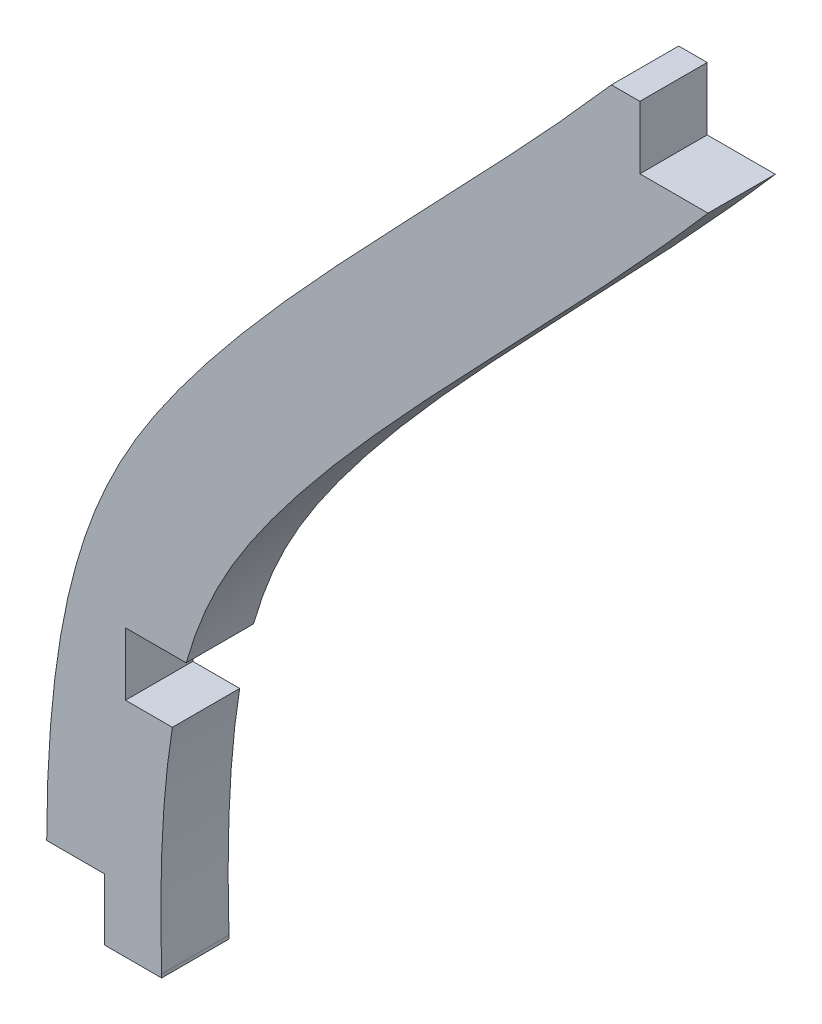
SolidWorks part; units mm, degrees
ref_plane "Front Plane" through (0, 0, 0) normal (0, 0, 1) x (1, 0, 0)
ref_plane "Top Plane" through (0, 0, 0) normal (0, 1, 0) x (1, 0, 0)
ref_plane "Right Plane" through (0, 0, 0) normal (1, 0, 0) x (0, 0, -1)
sketch "Sketch2" plane through (0, 0, 0) normal (0, 0, 1) x (1, 0, 0)
  line L0 (0, 0) -> (0, 106.68) construction
  line L1 (0, 0) -> (-76.2, 0) construction
  line L2 (0, 106.68) -> (-28.575, 106.68) construction
  line L3 (0, 0) -> (0, 106.68) construction
  line L4 (-75.27, 12.7) -> (0, 12.7) construction
  line L5 (-51.0976, 44.45) -> (0, 44.45) construction
  line L6 (-71.1223, 0.1523) -> (-71.1223, 0)
  line L7 (-71.1223, 0) -> (-76.2, 0)
  line L8 (-28.575, 106.68) -> (-23.5432, 106.68)
  line L10 (-23.5432, 105.9822) -> (-23.5432, 106.68)
  spline S0 degree 3 poles (-76.2, 0) (-76.5697, 12.3264) (-70.4254, 26.7635) (-35.695, 54.9593) (-31.1223, 88.3123) (-28.575, 106.68) knots 0 0 0 0 0.192928 0.526147 1 1 1 1
  spline S1 degree 1 poles (-71.1223, 0.1523) (-23.5432, 105.9822) knots 0 0 1 1 construction
  spline S2 degree 3 poles (-71.1223, 0.1523) (-71.1361, 0.6121) (-71.1567, 1.5498) (-71.1646, 3.2821) (-71.1168, 5.2862) (-70.9731, 7.4216) (-70.6767, 9.951) (-70.1306, 12.5718) (-69.2454, 15.1046) (-68.1202, 17.3344) (-66.6722, 19.5511) (-64.8631, 21.9349) (-62.1184, 25.2082) (-58.1372, 29.5028) (-52.8597, 34.9642) (-47.4482, 40.7915) (-42.2515, 47.0605) (-37.6918, 53.9253) (-34.0642, 61.0843) (-31.1698, 68.4658) (-28.9001, 75.9825) (-27.1227, 83.5631) (-25.7154, 91.1411) (-24.7522, 97.394) (-24.0486, 102.3357) (-23.7122, 104.7629) (-23.5432, 105.9822) knots 0 0 0 0 0.007812 0.015625 0.03125 0.046875 0.0625 0.09375 0.125 0.15625 0.1875 0.21875 0.25 0.3125 0.375 0.4375 0.5 0.5625 0.625 0.6875 0.75 0.8125 0.875 0.9375 0.96875 1 1 1 1
  dimension "D1" = 106.68
  dimension "D2" = 28.575
  dimension "D3" = 76.2
  dimension "D4" = 12.7
  dimension "D5" = 44.45
  dimension "D6" = 75.27
  dimension "D7" = 51.0976
  dimension "D8" = 5.08
extrude "Boss-Extrude1" add sketch "Sketch2" along normal blind 2.9972
sketch "Sketch3" plane through (0, 0, 2.9972) normal (0, 0, 1) x (1, 0, 0)
  line L0 (-73.66, 0) -> (-73.66, 2.7432)
  line L1 (-71.1223, 0) -> (-76.2, 0) construction
  line L2 (-73.66, 2.7432) -> (-76.2391, 2.7432)
  line L3 (-73.66, 0) -> (-76.5672, 0)
  line L4 (-76.5672, 0) -> (-76.2391, 2.7432)
  line L5 (-70.0285, 12.7) -> (-72.73, 12.7)
  line L6 (-75.27, 12.7) -> (0, 12.7) construction
  line L7 (-72.73, 12.7) -> (-72.73, 9.906)
  line L8 (-72.73, 9.906) -> (-70.643, 9.906)
  line L9 (-70.643, 9.906) -> (-70.0285, 12.7)
  line L10 (-44.4594, 44.45) -> (-49.8276, 44.45)
  line L11 (-51.0976, 44.45) -> (0, 44.45) construction
  line L12 (-44.4594, 41.656) -> (-49.8276, 41.656)
  line L13 (-49.8276, 41.656) -> (-49.8276, 44.45)
  line L14 (-44.4594, 41.656) -> (-44.4594, 44.45)
  line L15 (-26.035, 106.68) -> (-26.035, 103.9368)
  line L16 (-28.575, 106.68) -> (-23.5432, 106.68) construction
  line L17 (-26.035, 103.9368) -> (-28.9563, 103.9368)
  line L18 (-28.9563, 103.9368) -> (-28.9563, 106.68)
  line L19 (-28.9563, 106.68) -> (-26.035, 106.68)
  spline S0 degree 3 poles (-76.2, 0) (-76.5697, 12.3264) (-70.4254, 26.7635) (-35.695, 54.9593) (-31.1223, 88.3123) (-28.575, 106.68) knots 0 0 0 0 0.192928 0.526147 1 1 1 1 construction
  spline S1 degree 3 poles (-71.1223, 0.1523) (-71.1361, 0.6121) (-71.1567, 1.5498) (-71.1646, 3.2821) (-71.1168, 5.2862) (-70.9731, 7.4216) (-70.6767, 9.951) (-70.1306, 12.5718) (-69.2454, 15.1046) (-68.1202, 17.3344) (-66.6722, 19.5511) (-64.8631, 21.9349) (-62.1184, 25.2082) (-58.1372, 29.5028) (-52.8597, 34.9642) (-47.4482, 40.7915) (-42.2515, 47.0605) (-37.6918, 53.9253) (-34.0642, 61.0843) (-31.1698, 68.4658) (-28.9001, 75.9825) (-27.1227, 83.5631) (-25.7154, 91.1411) (-24.7522, 97.394) (-24.0486, 102.3357) (-23.7122, 104.7629) (-23.5432, 105.9822) knots 0 0 0 0 0.007812 0.015625 0.03125 0.046875 0.0625 0.09375 0.125 0.15625 0.1875 0.21875 0.25 0.3125 0.375 0.4375 0.5 0.5625 0.625 0.6875 0.75 0.8125 0.875 0.9375 0.96875 1 1 1 1 construction
  dimension "D1" = 2.54
  dimension "D2" = 2.7432
  dimension "D3" = 2.54
  dimension "D4" = 2.794
  dimension "D5" = 1.27
  dimension "D6" = 2.54
  dimension "D7" = 2.7432
  dimension "D8" = 2.794
extrude "Cut-Extrude1" cut sketch "Sketch3" against normal blind 2.9972
sketch "Sketch4" plane through (0, 0, 2.9972) normal (0, 0, 1) x (1, 0, 0)
  line L0 (-48.5576, 44.45) -> (-52.1716, 44.45) construction
  line L2 (-52.1716, 44.45) -> (-14.0783, 44.45)
  line L3 (-52.1716, 44.45) -> (-52.1716, 114.7823)
  line L4 (-52.1716, 114.7823) -> (-14.0783, 114.7823)
  line L5 (-14.0783, 44.45) -> (-14.0783, 114.7823)
extrude "Cut-Extrude2" cut sketch "Sketch4" against normal blind 7.62
